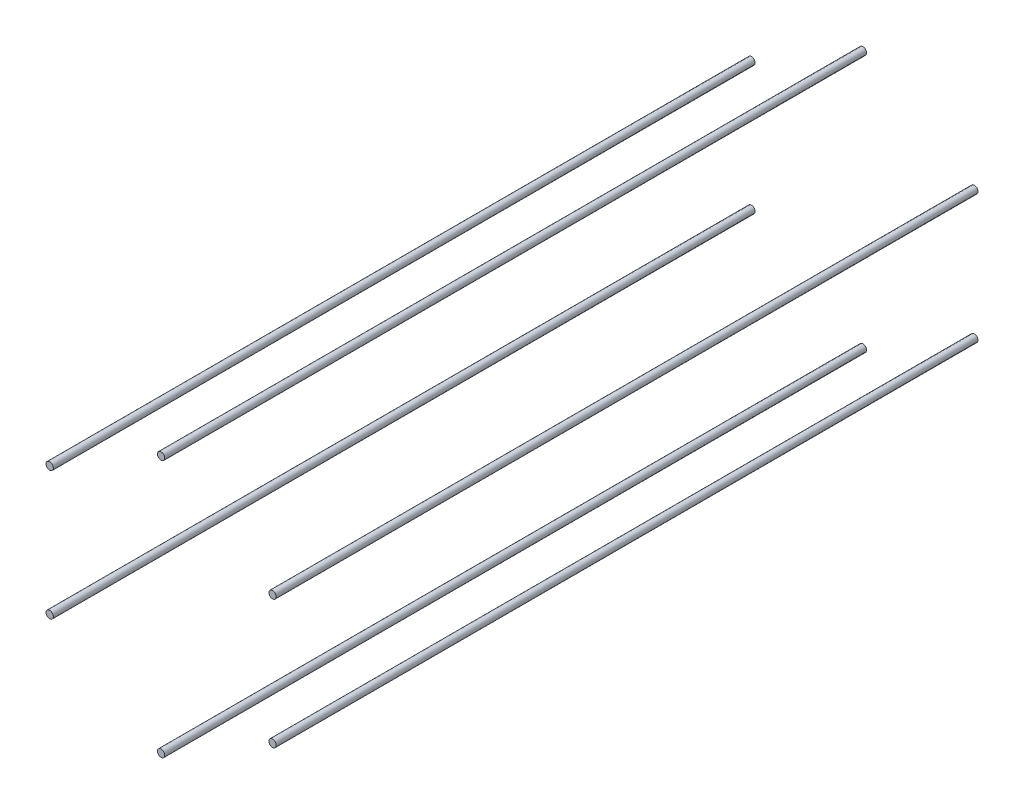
SolidWorks part; units mm, degrees
ref_plane "Front Plane" through (0, 0, 0) normal (1, 0, 0) x (0, 1, 0)
ref_plane "Top Plane" through (0, 0, 0) normal (0, 0, 1) x (0, 1, 0)
ref_plane "Right Plane" through (0, 0, 0) normal (0, 1, 0) x (-1, 0, 0)
sketch "Hex 6in Beam" plane through (0, 0, 0) normal (0, 0, 1) x (0, 1, 0)
  line L1 (115.4305, -199.9315) -> (230.8611, 0)
  line L2 (230.8611, 0) -> (115.4305, 199.9315)
  line L3 (115.4305, 199.9315) -> (-115.4305, 199.9315)
  line L4 (-115.4305, 199.9315) -> (-230.8611, 0)
  line L5 (-230.8611, 0) -> (-115.4305, -199.9315)
  line L6 (-115.4305, -199.9315) -> (115.4305, -199.9315)
  circle A0 centre (0, 0) radius 199.9315 construction
  line B0 (76.2, 76.2) -> (215.5261, 215.5261) construction
  line B1 (-76.2, 76.2) -> (76.2, 76.2) construction
  line B2 (-76.2, 76.2) -> (-76.2, -76.2) construction
  line B3 (-76.2, -76.2) -> (76.2, -76.2) construction
  line B4 (76.2, 76.2) -> (76.2, -76.2) construction
  line B5 (-76.2, 76.2) -> (76.2, -76.2) construction
  line B6 (-76.2, -76.2) -> (76.2, 76.2) construction
  line B7 (238.1934, 0) -> (119.0967, 206.2815)
  line B8 (119.0967, 206.2815) -> (-119.0967, 206.2815)
  line B9 (-119.0967, 206.2815) -> (-238.1934, 0)
  line B10 (-238.1934, 0) -> (-119.0967, -206.2815)
  line B11 (-119.0967, -206.2815) -> (119.0967, -206.2815)
  line B12 (119.0967, -206.2815) -> (238.1934, 0)
  circle B13 centre (0, 0) radius 206.2815 construction
  dimension "D1" = 6.35
sketch_block_instance "Blk 6in Hex-1"
sketch_block "Blk 6in Hex" parameters "D1"=152.4, "D2"=152.4
sketch "Sketch2" plane through (0, 0, 0) normal (0, 0, 1) x (0, 1, 0)
  line L0 (230.8611, 0) -> (115.4305, 199.9315) construction
  circle A0 centre (223.5287, 0) radius 6.35
  circle A1 centre (111.7644, -193.5815) radius 6.35
  circle A2 centre (-111.7644, -193.5815) radius 6.35
  circle A3 centre (-223.5287, 0) radius 6.35
  circle A4 centre (-111.7644, 193.5815) radius 6.35
  circle A5 centre (111.7644, 193.5815) radius 6.35
  point P17 (0, 0)
  dimension "D1" = 12.7
  dimension "D2" = 6
extrude "Boss-Extrude1" add sketch "Sketch2" along normal mid plane 1219.2
